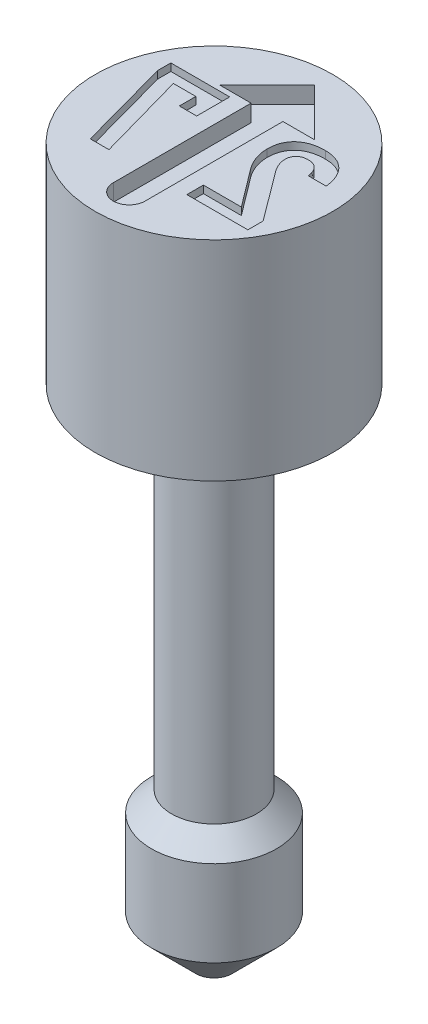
SolidWorks part; units mm, degrees
ref_plane "Front Plane" through (0, 0, 0) normal (0, 0, 1) x (1, 0, 0)
ref_plane "Top Plane" through (0, 0, 0) normal (0, 1, 0) x (1, 0, 0)
ref_plane "Right Plane" through (0, 0, 0) normal (1, 0, 0) x (0, 0, -1)
sketch "Sketch1" plane through (0, 0, 0) normal (0, 0, 1) x (1, 0, 0)
  line L0 (0, 17.018) -> (2.8448, 17.018)
  line L1 (0, -3.1293) -> (0, 3.1293) construction
  line L2 (2.8448, 17.018) -> (2.8448, 12.0142)
  line L3 (2.8448, 12.0142) -> (1.016, 12.0142)
  line L4 (1.016, 12.0142) -> (1.016, 3.6068)
  line L5 (1.016, 3.6068) -> (1.4986, 3.1242)
  line L6 (1.4986, 3.1242) -> (1.4986, 1.0668)
  line L7 (1.4986, 1.0668) -> (0.4318, 0)
  line L8 (3.1293, 0) -> (-3.1293, 0) construction
  line L9 (0.4318, 0) -> (0, 0)
  line L10 (0, 0) -> (0, 17.018)
  line L11 (0, 0) -> (0, 64.9194) construction
  dimension "D1" = 17.018
  dimension "D2" = 3.6068
  dimension "D3" = 1.0668
  dimension "D4" = 45
  dimension "D5" = 2.9972
  dimension "D6" = 5.6896
  dimension "D7" = 2.032
  dimension "D8" = 5.0038
revolve "Revolve1" add sketch "Sketch1" angle 360 about L11
sketch "Sketch2" plane through (0, 17.018, 0) normal (0, 1, 0) x (1, 0, 0)
  line L1 (0.381, -2.032) -> (0.381, 1.27)
  line L2 (-0.381, -2.032) -> (-0.381, 1.27)
  line L3 (0, -3.1293) -> (0, 3.1293) construction
  line L4 (-0.381, 1.27) -> (-1.143, 1.27)
  line L5 (0.381, 1.27) -> (1.143, 1.27)
  line L6 (1.143, 1.27) -> (0, 2.413)
  line L7 (0, 2.413) -> (-1.143, 1.27)
  line L8 (-3.1293, 0) -> (3.1293, 0) construction
  arc A0 (-0.381, -2.032) -> (0.381, -2.032) centre (0, -2.032) ccw
  dimension "D6" = 2.032
  dimension "D1" = 0.762
  dimension "D2" = 0.381
  dimension "D3" = 2.286
  dimension "D4" = 1.143
  dimension "D5" = 45
  dimension "D7" = 1.27
extrude "Cut-Extrude1" cut sketch "Sketch2" against normal blind 0.4064
sketch "Sketch3" plane through (0, 17.018, 0) normal (0, 1, 0) x (1, 0, 0)
  text T0 "2 7" font "Bahnschrift SemiBold" height 2.54
  dimension "D1" = 2.413
  dimension "D2" = 1.397
extrude "Cut-Extrude2" cut sketch "Sketch3" against normal blind 0.1778
